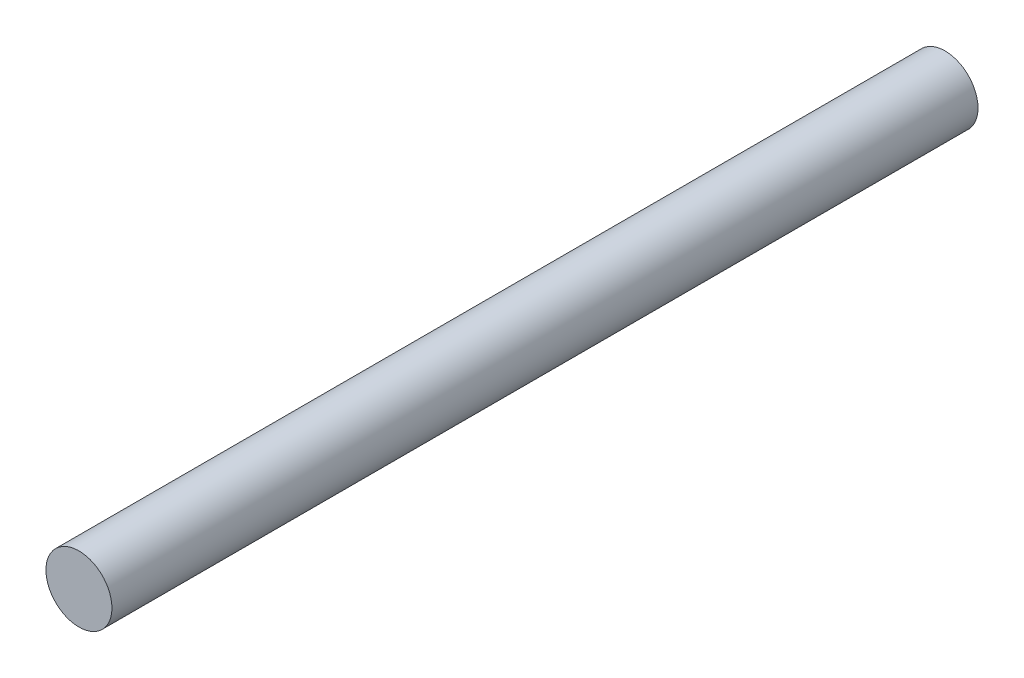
SolidWorks part; units mm, degrees
ref_plane "Front Plane" through (0, 0, 0) normal (0, 0, 1) x (1, 0, 0)
ref_plane "Top Plane" through (0, 0, 0) normal (0, 1, 0) x (1, 0, 0)
ref_plane "Right Plane" through (0, 0, 0) normal (1, 0, 0) x (0, 0, -1)
sketch "Sketch1" plane through (0, 0, 0) normal (0, 0, 1) x (1, 0, 0)
  circle A0 centre (0, 0) radius 5.715
  dimension "D1" = 11.43
extrude "Boss-Extrude1" add sketch "Sketch1" along normal blind 150
